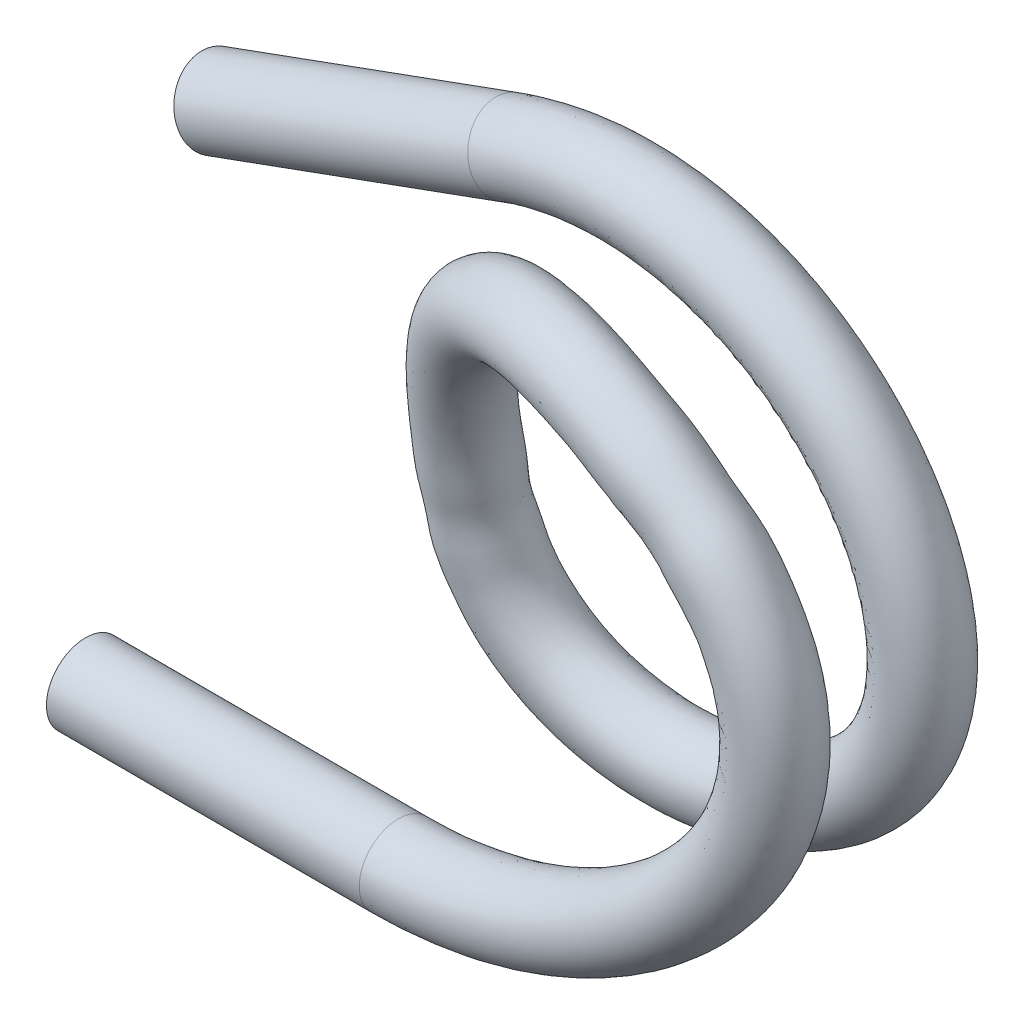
SolidWorks part; units mm, degrees
ref_plane "Plan de face" through (0, 0, 0) normal (0, 0, 1) x (1, 0, 0)
ref_plane "Plan de dessus" through (0, 0, 0) normal (0, 1, 0) x (1, 0, 0)
ref_plane "Plan de droite" through (0, 0, 0) normal (1, 0, 0) x (0, 0, -1)
sketch "Esquisse1" plane through (0, 0, 0) normal (1, 0, 0) x (0, 0, -1)
  line L0 (-47.1554, 0) -> (57.094, 0) construction
  line L1 (-42.718, 10) -> (51.9596, 10) construction
  circle A0 centre (-3, -3) radius 1.5
ref_plane "Plan1" through (3.2139, 1.1698, 0) normal (0.9397, 0.342, 0) x (0, 0, -1)
sketch "Esquisse2" plane through (3.2139, 1.1698, 0) normal (0.9397, 0.342, 0) x (0, 0, -1)
  line L1 (-42.718, 9.3969) -> (51.9596, 9.3969) construction
  circle A0 centre (3, 12.3969) radius 1.5
  dimension "D1" = 3
ref_plane "Plan2" through (0, 0, 3) normal (0, 0, 1) x (1, 0, 0)
ref_plane "Plan3" through (0, 0, -3) normal (0, 0, 1) x (1, 0, 0)
sketch "Esquisse3" plane through (0, 0, 3) normal (0, 0, 1) x (1, 0, 0)
  line L0 (0, -3.0162) -> (12, -3.0162)
  line L1 (0, -4.5) -> (0, -1.5) construction
  point P4 (-14.991, -2.0298)
sketch "Esquisse4" plane through (0, 0, -3) normal (0, 0, 1) x (1, 0, 0)
  line L0 (-1.0261, 12.8191) -> (10.2503, 16.9233)
  line L1 (6.737, -8.5098) -> (-0.3091, 10.8493) construction
  dimension "D1" = 12
sketch3d "Esquisse3D1"
  line L0 (0, -3, 3) -> (12, -3.0162, 3)
  line L1 (13.0298, 17.935, -3) -> (7.114, 15.7818, -3) construction
  line L2 (0.1995, 13.2652, -3) -> (10.2503, 16.9233, -3)
  line L3 (-1.0261, 12.8191, -3) -> (10.2503, 16.9233, -3) construction
  line L4 (10.6019, -3.0143, 3) -> (13.4046, -3.0181, 3) construction
  line L5 (19.6375, 18.5483, 0) -> (28.3669, 12.801, 0) construction
  line L6 (26.4958, 3.0651, 1.9693) -> (22.5378, -2.7364, 1.9693) construction
  line L7 (21.4745, -1.1903, -3) -> (28.5746, 9.2166, -3) construction
  line L8 (28.3866, 10.8661, 3.031) -> (10.6619, 22.5358, 3.031) construction
  spline S0 degree 3 poles (10.2503, 16.9233, -3) (20.5797, 20.6829, -3) (29.4769, 10.5392, -3) (21.3755, -1.3355, -3) (11.0291, -1.6268, -2.6539) (9.8977, 14.9701, -0.2917) (15.7653, 19.1758, 3.031) (31.7402, 8.6581, 3.031) (23.3299, -3.0315, 3) (12, -3.0162, 3) knots 0 0 0 0 0.279739 0.279739 0.489018 0.489018 0.70653 0.70653 1 1 1 1
sweep "Balayage1" add profiles "Esquisse2" path "Esquisse4"
sweep "Balayage2" add profiles "Esquisse1" path "Esquisse3D1"
